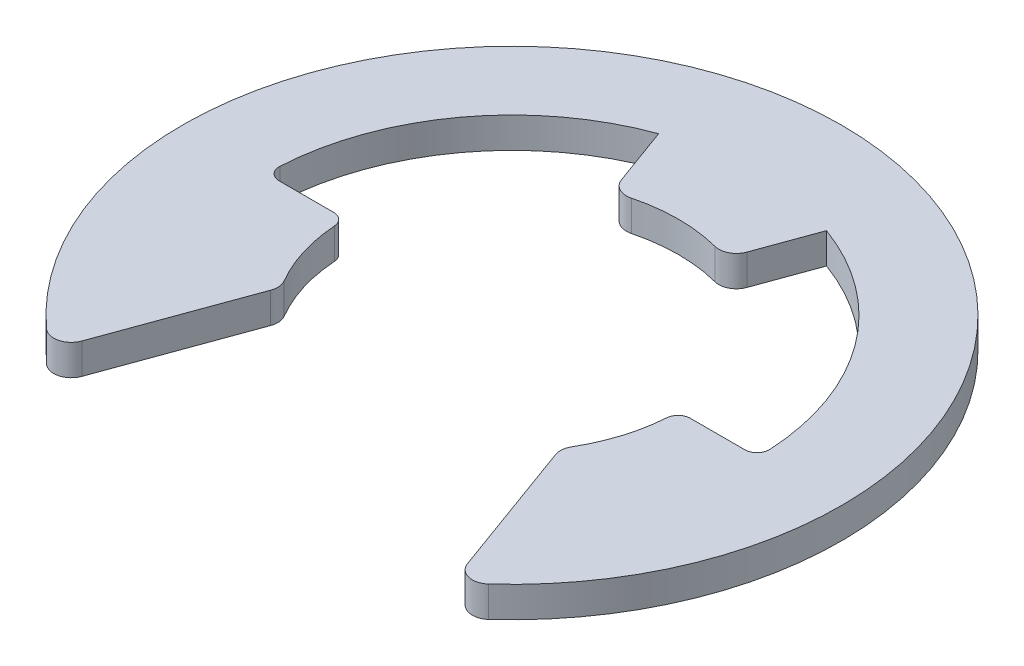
SolidWorks part; units mm, degrees
ref_plane "Front Plane" through (0, 0, 0) normal (0, 0, 1) x (1, 0, 0)
ref_plane "Top Plane" through (0, 0, 0) normal (0, 1, 0) x (1, 0, 0)
ref_plane "Right Plane" through (0, 0, 0) normal (1, 0, 0) x (0, 0, -1)
sketch "Sketch2" plane through (0, 0, 0) normal (0, 1, 0) x (1, 0, 0)
  line L0 (-11.4889, -14.881) -> (-7.96, -5.1854)
  line L2 (7.96, -5.1854) -> (11.4889, -14.881)
  line L4 (-9.5, 0) -> (-14, 0)
  line L5 (9.5, 0) -> (14, 0)
  line L6 (-4.7883, 13.1557) -> (-3.2492, 8.9271)
  line L8 (3.2492, 8.9271) -> (4.7883, 13.1557)
  arc A0 (11.4889, -14.881) -> (-11.4889, -14.881) centre (0, 0) ccw
  arc A1 (7.96, -5.1854) -> (9.5, 0) centre (0, 0) ccw
  arc A2 (14, 0) -> (4.7883, 13.1557) centre (0, 0) ccw
  arc A3 (-9.5, 0) -> (-7.96, -5.1854) centre (0, 0) ccw
  arc A4 (3.2492, 8.9271) -> (-3.2492, 8.9271) centre (0, 0) ccw
  arc A5 (-4.7883, 13.1557) -> (-14, 0) centre (0, 0) ccw
  point P15 (0, 0)
  point P16 (0, 9.5)
  dimension "D1" = 37.6
  dimension "D2" = 19
  dimension "D3" = 28
  dimension "D4" = 70
  dimension "D5" = 70
  dimension "D6" = 15.92
  dimension "D7" = 40
extrude "Boss-Extrude1" add sketch "Sketch2" along normal mid plane 1.75
fillet "Fillet1" radius 1 6 edges at (7.96, 0, 5.1854) (-7.96, 0, 5.1854) (3.2492, 0, -8.9271) (-3.2492, 0, -8.9271) (11.4889, 0, 14.881) (-11.4889, 0, 14.881)
fillet "Fillet2" radius 0.7 4 edges at (14, 0, 0) (9.5, 0, 0) (-14, 0, 0) (-9.5, 0, 0)
